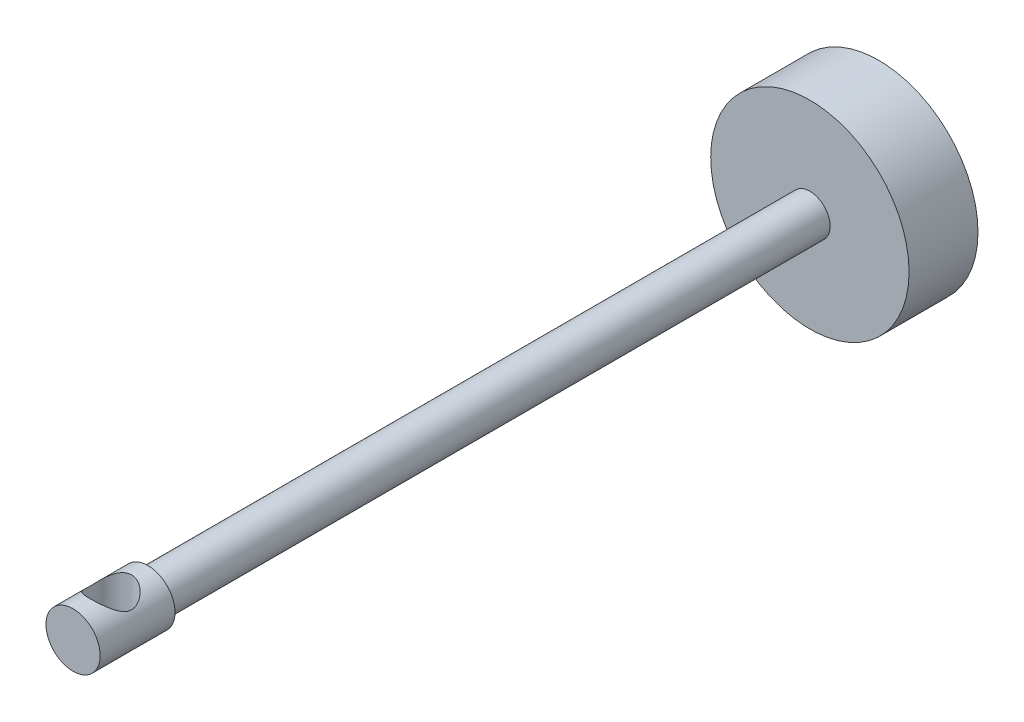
SolidWorks part; units mm, degrees
ref_plane "Front" through (0, 0, 0) normal (0, 0, 1) x (1, 0, 0)
ref_plane "Top" through (0, 0, 0) normal (0, 1, 0) x (1, 0, 0)
ref_plane "Right" through (0, 0, 0) normal (1, 0, 0) x (0, 0, -1)
sketch "Sketch1" plane through (0, 0, 0) normal (0, 0, 1) x (1, 0, 0)
  circle A0 centre (0, 0) radius 11.5164
  dimension "D1" = 23.0327
extrude "Extrude1" add sketch "Sketch1" along normal blind 8.001
sketch "Sketch2" plane through (0, 0, 0) normal (0, 0, 1) x (1, 0, 0)
  circle A0 centre (0, 0) radius 2.3495
  dimension "D1" = 4.699
extrude "Extrude2" add sketch "Sketch2" along normal blind 93.5482
sketch "Sketch3" plane through (0, 0, 93.5482) normal (0, 0, 1) x (1, 0, 0)
  circle A0 centre (0, 0) radius 3.1496
  circle A1 centre (0, 0) radius 2.3495 construction
  dimension "D1" = 6.2992
extrude "Extrude3" add sketch "Sketch3" against normal blind 8.6868
sketch "Sketch4" plane through (0, 0, 0) normal (0, 1, 0) x (1, 0, 0)
  circle A0 centre (0, -89.154) radius 2.4003
  dimension "D2" = 4.8006
  dimension "D1" = 89.154
extrude "Cut-Extrude1" cut sketch "Sketch4" against normal through all and the other way through all
